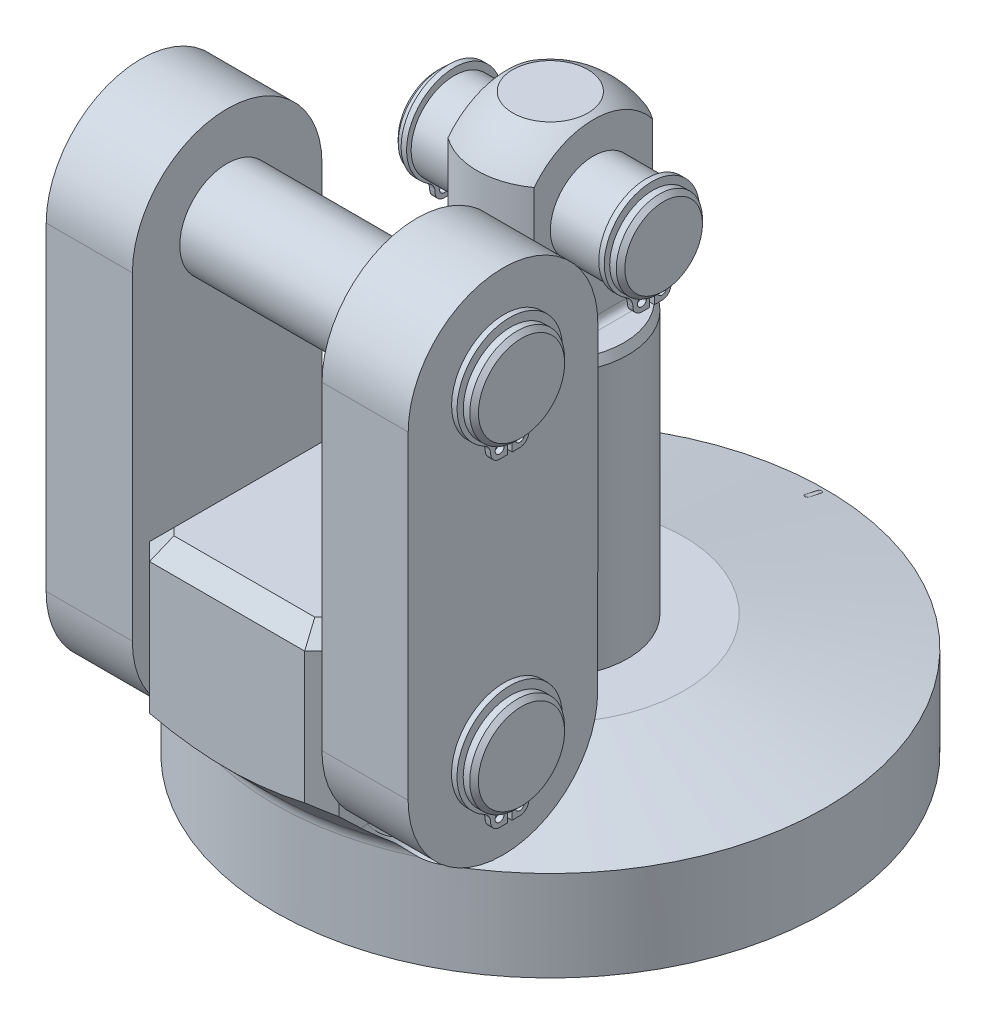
SolidWorks part; units mm, degrees
ref_plane "Front Plane" through (0, 0, 0) normal (0, 0, 1) x (1, 0, 0)
ref_plane "Top Plane" through (0, 0, 0) normal (0, 1, 0) x (1, 0, 0)
ref_plane "Right Plane" through (0, 0, 0) normal (1, 0, 0) x (0, 0, -1)
sketch "Sketch1" plane through (0, 0, 0) normal (0, 1, 0) x (1, 0, 0)
  line L0 (-11, 0) -> (11, 0)
  line L1 (11, 0) -> (11, -37.5)
  line L2 (11, -37.5) -> (-11, -37.5)
  line L3 (-11, -37.5) -> (-11, 0)
  line L4 (0, 1.05) -> (0, -22.05) construction
  dimension "D1" = 22
  dimension "D2" = 37.5
extrude "Extrude1" add sketch "Sketch1" along normal blind 35.5
sketch "S2D0003" plane through (0, 0, 0) normal (1, 0, 0) x (0, 0, -1)
  line L0 (0, 0) -> (0, 14)
  line L1 (-37.5, 0) -> (0, 0)
  line L2 (-37.5, 0) -> (-37.5, 9.3238)
  line L3 (0, 14) -> (-15.5, 14)
  line L4 (-15.5, 14) -> (-37.5, 9.3238)
  line L5 (0, 9.45) -> (0, -2.5987) construction
  line L6 (0, 35.5) -> (0, 0) construction
  line L8 (-37.5, 0) -> (0, 0) construction
  line L10 (-37.5, 35.5) -> (-37.5, 0) construction
  dimension "D1" = 14
  dimension "D2" = 12
  dimension "D3" = 31
sketch "S2D0004" plane through (0, 0, 0) normal (1, 0, 0) x (0, 0, -1)
  line L0 (-47.5076, 27.1929) -> (-32.5536, 12.2389)
  line L1 (-31.9659, 10.82) -> (-31.9659, 0)
  line L2 (0, 16.6313) -> (0, -1.1122) construction
  line L3 (0, 35.5) -> (0, 0) construction
  line L5 (-37.5, 0) -> (0, 0) construction
  line L6 (-47.5076, 27.1929) -> (-47.5076, 0)
  line L7 (-47.5076, 0) -> (-31.9659, 0)
  line L8 (-37.5, 35.5) -> (-37.5, 0) construction
  arc A0 (-31.9659, 10.82) -> (-32.5536, 12.2389) centre (-33.9725, 10.82) ccw
  dimension "D4" = 2.0066
  dimension "D1" = 63.9318
  dimension "D2" = 10.82
  dimension "D3" = 45
  dimension "D5" = 10.0076
sketch "Sketch4" plane through (0, 0, 0) normal (1, 0, 0) x (0, 0, -1)
  line L0 (0, 14) -> (15.5, 14)
  line L1 (15.5, 14) -> (15.5, 35.5)
  line L2 (15.5, 35.5) -> (0, 35.5)
  line L3 (0, 35.5) -> (0, 14)
  line L4 (0, 21.6) -> (0, 8.4) construction
  line L5 (0, 35.5) -> (0, 0) construction
  line L6 (-37.5, 35.5) -> (0, 35.5) construction
  dimension "D1" = 31
  dimension "D2" = 21.5
revolve "Cut-Revolve5" cut sketch "Sketch4" angle 360 about L4
revolve "Revolve1" add sketch "S2D0003" angle 360 about L5
revolve "Cut-Revolve4" cut sketch "S2D0004" angle 360 about L2
sketch "Sketch7" plane through (11, 0, 0) normal (1, 0, 0) x (0, 0, -1)
  line L0 (-31.9659, 0) -> (31.9659, 0) construction
  circle A0 centre (-26.5, 24.5) radius 5.5
  dimension "D1" = 11
  dimension "D2" = 24.5
  dimension "D3" = 26.5
extrude "Cut-Extrude3" cut sketch "Sketch7" against normal through all
fillet "Fillet1" radius 3 2 edges at (-11, 24.75, 10.9202) (11, 24.75, 10.9202)
fillet "Fillet2" radius 4.76 5 edges at (-9.5428, 13.6743, 14.1079) (0, 14, 15.5) (9.5428, 13.6743, 14.1079)
chamfer "Chamfer1" distance 2 angle 45 2 edges at (-11, 27.1327, 37.5) (11, 27.1327, 37.5)
chamfer "Chamfer2" distance 2 angle 45 8 edges at (-11, 35.5, 26.0904) (-9.5981, 35.5, 14.1419) (0, 35.5, 15.5) (9.5981, 35.5, 14.1419) (-10, 35.5, 36.5) (11, 35.5, 26.0904) (10, 35.5, 36.5) (0, 35.5, 37.5)
ref_plane "Plane1" through (0, 0, 26.5) normal (0, 0, 1) x (1, 0, 0)
sketch "Sketch8" plane through (0, 0, 26.5) normal (0, 0, 1) x (1, 0, 0)
  line L0 (11, 24.5) -> (11, 12.9908)
  line L1 (12.14, 11.8508) -> (23.64, 11.8508)
  line L2 (23.64, 11.8508) -> (23.64, 24.5)
  line L3 (23.64, 24.5) -> (11, 24.5)
  line L4 (5.637, 24.5) -> (19.4125, 24.5) construction
  line L5 (-11, 24.5) -> (11, 24.5) construction
  line L6 (11, 35.5) -> (11, 18.7653) construction
  line L7 (0, 0) -> (0, 26.6501) construction
  line L8 (-23.64, 24.5) -> (-11, 24.5)
  line L9 (-23.64, 11.8508) -> (-23.64, 24.5)
  line L10 (-12.14, 11.8508) -> (-23.64, 11.8508)
  line L11 (-11, 24.5) -> (-11, 12.9908)
  arc A0 (11, 12.9908) -> (12.14, 11.8508) centre (12.14, 12.9908) ccw
  arc A1 (-11, 12.9908) -> (-12.14, 11.8508) centre (-12.14, 12.9908) cw
  dimension "D4" = 1.14
  dimension "D2" = 25.2984
  dimension "D3" = 12.64
revolve "Cut-Revolve6" cut sketch "Sketch8" angle 360 about L4
sketch "Sketch10" plane through (0, 0, 0) normal (1, 0, 0) x (0, 0, -1)
  line L0 (0, 14) -> (0, 66.5)
  line L1 (0, 66.5) -> (4.3589, 66.5)
  line L2 (8.5, 62.7678) -> (8.5, 45.5723)
  line L3 (8.5, 45.5723) -> (9, 44.5)
  line L4 (9, 44.5) -> (9, 14)
  line L5 (9, 14) -> (0, 14)
  line L6 (0, 44.745) -> (0, 7.55) construction
  line L7 (22.759, -20) -> (-24.5324, -20) construction
  line L9 (15.5, 14) -> (-9.8797, 14) construction
  arc A0 (8.5, 62.7678) -> (4.3589, 66.5) centre (0, 57.5) ccw
  circle A1 centre (0, 57.5) radius 5 construction
  dimension "D2" = 10
  dimension "D3" = 10
  dimension "D5" = 77.5
  dimension "D1" = 9
  dimension "D4" = 34
  dimension "D6" = 18
  dimension "D7" = 17
  dimension "D8" = 25
  dimension "D9" = 22
  dimension "D10" = 30.5
  dimension "D11" = 52.5
revolve "Revolve2" add sketch "Sketch10" angle 360 about L6
sketch "Sketch12" plane through (0, 0, 0) normal (0, 0, 1) x (1, 0, 0)
  line L0 (5, 66.5) -> (9, 66.5)
  line L1 (9, 66.5) -> (9, 45.5)
  line L2 (9, 45.5) -> (5.8, 45.5)
  line L3 (5, 46.3) -> (5, 66.5)
  line L4 (4.3589, 66.5) -> (-4.3589, 66.5) construction
  line L5 (9, 14) -> (9, 44.5) construction
  line L6 (-5, 46.3) -> (-5, 66.5)
  line L7 (-9, 45.5) -> (-5.8, 45.5)
  line L8 (0, 38.525) -> (0, 26.975) construction
  line L9 (-9, 66.5) -> (-9, 45.5)
  line L10 (-5, 66.5) -> (-9, 66.5)
  arc A0 (5, 46.3) -> (5.8, 45.5) centre (5.8, 46.3) ccw
  arc A1 (-5, 46.3) -> (-5.8, 45.5) centre (-5.8, 46.3) cw
  dimension "D3" = 0.8
  dimension "D1" = 10
  dimension "D2" = 21
extrude "Cut-Extrude5" cut sketch "Sketch12" against normal mid plane 20
sketch "Sketch14" plane through (5, 0, 0) normal (1, 0, 0) x (0, 0, -1)
  line L0 (4.3589, 66.5) -> (-4.3589, 66.5) construction
  circle A0 centre (0, 57.5) radius 5
  dimension "D2" = 10
  dimension "D1" = 9
extrude "Cut-Extrude7" cut sketch "Sketch14" against normal up to next
sketch "S2D0005" plane through (11, 0, 0) normal (1, 0, 0) x (0, 0, -1)
  line L0 (-37.4904, 61.5029) -> (-37.5, 24.5029)
  line L1 (-15.4904, 61.4971) -> (-15.5, 24.4971)
  line L2 (-26.4904, 61.5) -> (-26.5, 24.5) construction
  line L3 (0, 57.5) -> (0.0018, 61.4878) construction
  line L4 (0.0018, 61.4878) -> (-26.4904, 61.5) construction
  arc A0 (-15.4904, 61.4971) -> (-37.4904, 61.5029) centre (-26.4904, 61.5) ccw
  arc A1 (-37.5, 24.5029) -> (-15.5, 24.4971) centre (-26.5, 24.5) ccw
  circle A2 centre (-26.4904, 61.5) radius 5.5
  circle A3 centre (-26.5, 24.5) radius 5.5
  circle A6 centre (-26.5, 24.5) radius 5.5 construction
  dimension "D2" = 37
  dimension "D1" = 22
  dimension "D3" = 26.4922
  dimension "D4" = 3.9878
extrude "Extrude2" add sketch "S2D0005" along normal blind 10
sketch "S2D0006" plane through (0, 0, 0) normal (0, 0, 1) x (1, 0, 0)
  line L0 (-11.15, 62.5) -> (11.15, 62.5)
  line L1 (13.15, 62) -> (13.15, 57.5)
  line L2 (12.65, 62.5) -> (13.15, 62)
  line L3 (11.89, 62.5) -> (12.65, 62.5)
  line L4 (11.89, 62.185) -> (11.89, 62.5)
  line L5 (11.15, 62.185) -> (11.89, 62.185)
  line L6 (11.15, 62.5) -> (11.15, 62.185)
  line L7 (13.15, 57.5) -> (-13.15, 57.5)
  line L8 (-11.15, 62.5) -> (-11.15, 62.185)
  line L9 (-11.15, 62.185) -> (-11.89, 62.185)
  line L10 (-11.89, 62.185) -> (-11.89, 62.5)
  line L11 (-11.89, 62.5) -> (-12.65, 62.5)
  line L12 (-12.65, 62.5) -> (-13.15, 62)
  line L13 (-13.15, 62) -> (-13.15, 57.5)
  line L14 (-8.415, 57.5) -> (8.415, 57.5) construction
  line L15 (-5, 57.5) -> (5, 57.5) construction
  line L16 (0, 40.8686) -> (0, 24.9357) construction
  line L17 (0, 45.5723) -> (0, 62.7678) construction
  line L18 (5, 62.5) -> (-5, 62.5) construction
  dimension "D1" = 26.3
  dimension "D3" = 0.74
  dimension "D4" = 9.37
  dimension "D5" = 22.3
  dimension "D6" = 0.5
  dimension "D7" = 45
revolve "Revolve3" add sketch "S2D0006" angle 360 about L14
ref_plane "Plane2" through (0, 0, 26.5) normal (0, 0, 1) x (1, 0, 0)
sketch "Sketch18" plane through (0, 0, 26.5) normal (0, 0, 1) x (1, 0, 0)
  line L0 (-21.15, 30) -> (21.15, 30)
  line L1 (23.15, 29.5) -> (23.15, 24.5)
  line L2 (22.65, 30) -> (23.15, 29.5)
  line L3 (21.89, 30) -> (22.65, 30)
  line L4 (21.89, 29.73) -> (21.89, 30)
  line L5 (21.15, 29.73) -> (21.89, 29.73)
  line L6 (21.15, 30) -> (21.15, 29.73)
  line L7 (-21.15, 30) -> (-21.15, 29.73)
  line L8 (-21.15, 29.73) -> (-21.89, 29.73)
  line L9 (-21.89, 29.73) -> (-21.89, 30)
  line L10 (-21.89, 30) -> (-22.65, 30)
  line L11 (-22.65, 30) -> (-23.15, 29.5)
  line L12 (-23.15, 29.5) -> (-23.15, 24.5)
  line L13 (-13.915, 24.5) -> (13.915, 24.5) construction
  line L14 (-11, 24.5) -> (21, 24.5) construction
  line L15 (0, 28.7058) -> (0, -18.8155) construction
  line L16 (-23.15, 24.5) -> (23.15, 24.5)
  line L17 (21, 30) -> (-11, 30) construction
  dimension "D2" = 46.3
  dimension "D3" = 10.46
  dimension "D4" = 0.74
  dimension "D5" = 42.3
  dimension "D6" = 0.5
  dimension "D7" = 45
revolve "Revolve4" add sketch "Sketch18" angle 360 about L13
sketch "Sketch20" plane through (11.15, 0, 0) normal (1, 0, 0) x (0, 0, -1)
  line L0 (0.2762, 50.8025) -> (1.169, 50.8025)
  line L1 (0.2762, 53.0125) -> (0.2762, 50.8025)
  line L2 (-0.2763, 53.0125) -> (-0.2763, 50.8025)
  line L3 (-0.2763, 50.8025) -> (-1.169, 50.8025)
  line L4 (0, 30.527) -> (0, 23.2449) construction
  arc A0 (0.2762, 53.0125) -> (-0.2763, 53.0125) centre (0, 57.5) ccw
  arc A1 (2.9036, 53.0869) -> (-2.9036, 53.0869) centre (0, 57.7894) ccw
  circle A2 centre (0, 57.5) radius 5 construction
  circle A3 centre (1.169, 51.8435) radius 0.5205
  arc A4 (2.21, 51.8435) -> (1.169, 50.8025) centre (1.169, 51.8435) cw
  arc A5 (-2.21, 51.8435) -> (-2.9036, 53.0869) centre (-3.6714, 51.8435) ccw
  arc A6 (-2.21, 51.8435) -> (-1.169, 50.8025) centre (-1.169, 51.8435) ccw
  circle A7 centre (-1.169, 51.8435) radius 0.5205
  arc A8 (2.21, 51.8435) -> (2.9036, 53.0869) centre (3.6714, 51.8435) cw
  dimension "D1" = 0.5525
  dimension "D2" = 4.496
  dimension "D3" = 5.5266
  dimension "D4" = 0.2894
  dimension "D6" = 1.041
  dimension "D9" = 1.041
  dimension "D10" = 1.4614
  dimension "D7" = 2.338
  dimension "D8" = 5.6565
extrude "Extrude4" add sketch "Sketch20" along normal blind 0.635
sketch "Sketch21" plane through (21.15, 0, 0) normal (1, 0, 0) x (0, 0, -1)
  line L0 (-26.2225, 17.2574) -> (-25.3329, 17.2572)
  line L1 (-26.2219, 19.4927) -> (-26.2225, 17.2574)
  line L2 (-26.7807, 19.4929) -> (-26.7813, 17.2576)
  line L3 (-26.7813, 17.2576) -> (-27.6709, 17.2578)
  line L4 (-26.5045, 7.2804) -> (-26.5061, 0.9847) construction
  line L5 (-37.4904, 61.5029) -> (-37.5, 24.5029) construction
  arc A0 (-26.2219, 19.4927) -> (-26.7807, 19.4929) centre (-26.5, 24.5) ccw
  arc A1 (-23.6192, 19.406) -> (-29.3834, 19.4075) centre (-26.4999, 24.7984) ccw
  circle A2 centre (-25.3326, 18.2982) radius 0.5205
  arc A3 (-24.2916, 18.292) -> (-25.3329, 17.2572) centre (-25.3326, 18.2982) cw
  arc A4 (-24.2916, 18.292) -> (-23.6192, 19.406) centre (-23.0201, 18.2844) cw
  arc A5 (-28.7116, 18.2931) -> (-29.3834, 19.4075) centre (-29.9832, 18.2862) ccw
  arc A6 (-28.7116, 18.2931) -> (-27.6709, 17.2578) centre (-27.6706, 18.2988) ccw
  circle A7 centre (-27.6706, 18.2988) radius 0.5205
  circle A8 centre (-26.5, 24.5) radius 5.5 construction
  dimension "D1" = 5.015
  dimension "D2" = 6.1136
  dimension "D3" = 0.2984
  dimension "D7" = 1.041
  dimension "D8" = 1.041
  dimension "D9" = 6.2012
  dimension "D10" = 1.2716
  dimension "D4" = 0.5587
  dimension "D6" = 2.338
extrude "Extrude5" add sketch "Sketch21" along normal blind 0.635
pattern_linear "LPattern1" count 2 spacing 37 along (0, 1, -0.0003) of "Extrude5", "Revolve4"
mirror "Mirror1" about plane through (0, 0, 0) normal (1, 0, 0) of "Extrude5", "LPattern1", "Extrude4", "Extrude2"
sketch "Sketch22" plane through (0, 0, 0) normal (1, 0, 0) x (0, 0, -1)
  line L0 (32.173, 11.233) -> (29.5546, 11.7896) construction
  line L1 (31.9659, 10.5001) -> (15.5, 14) construction
  line L2 (31.4768, 10.604) -> (29.5205, 11.0198) construction
  line L3 (31.3905, 11.3993) -> (29.9229, 11.7113) construction
  line L4 (31.2242, 10.6168) -> (29.7566, 10.9288)
  line L6 (29.1404, 11.8776) -> (32.173, 11.233)
  arc A0 (31.2242, 10.6168) -> (32.173, 11.233) centre (31.3905, 11.3993) ccw
  arc A1 (29.1404, 11.8776) -> (29.7566, 10.9288) centre (29.9229, 11.7113) ccw
  dimension "D1" = 1.6
  dimension "D2" = 2
  dimension "D3" = 0.5
  dimension "D4" = 0.76
  dimension "D5" = 0.04
revolve "Cut-Revolve7" cut sketch "Sketch22" angle 360 about L6
